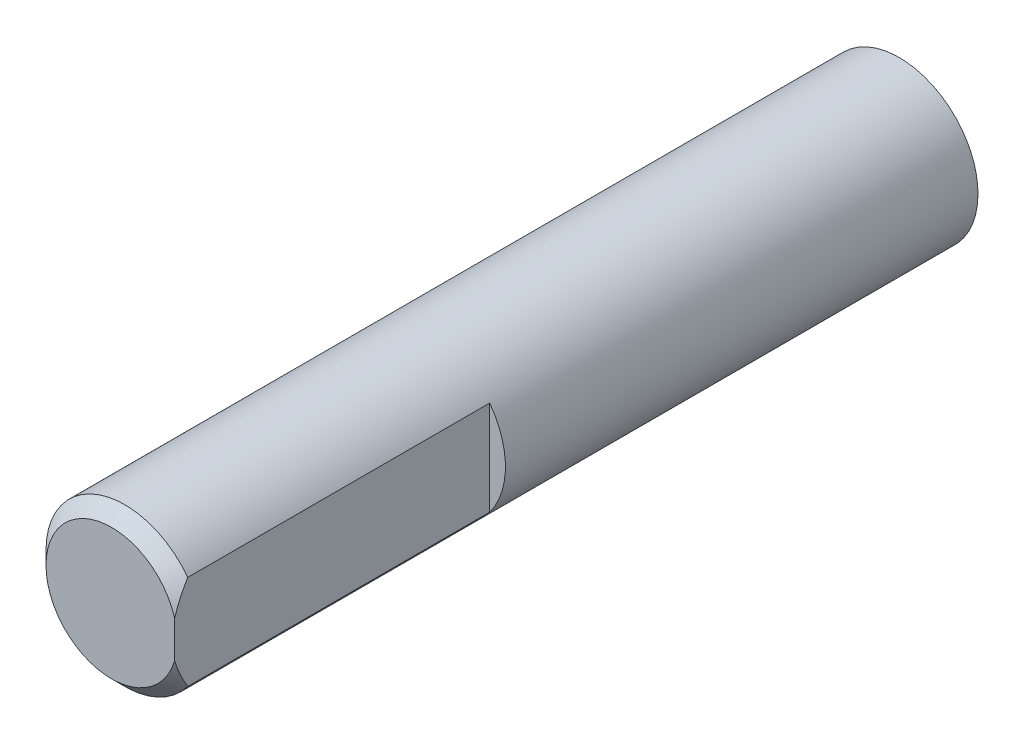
SolidWorks part; units mm, degrees
ref_plane "Plan de face" through (0, 0, 0) normal (0, 0, 1) x (1, 0, 0)
ref_plane "Plan de dessus" through (0, 0, 0) normal (0, 1, 0) x (1, 0, 0)
ref_plane "Plan de droite" through (0, 0, 0) normal (1, 0, 0) x (0, 0, -1)
sketch "Esquisse1" plane through (0, 0, 0) normal (0, 0, 1) x (1, 0, 0)
  circle A0 centre (0, 0) radius 3
  dimension "D1" = 6
extrude "Boss.-Extru.1" add sketch "Esquisse1" along normal blind 30
chamfer "Chanfrein1" distance 0.5 angle 45 1 edges at (3, 0, 30)
sketch "Esquisse3" plane through (0, 0, 30) normal (0, 0, 1) x (1, 0, 0)
  line L0 (0, 0) -> (3.4, 0) construction
  line L2 (2.4, 2.5) -> (4.4, 2.5)
  line L3 (2.4, 2.5) -> (2.4, -2.5)
  line L4 (2.4, -2.5) -> (4.4, -2.5)
  line L5 (4.4, 2.5) -> (4.4, -2.5)
  line L6 (2.4, 2.5) -> (4.4, -2.5) construction
  line L7 (2.4, -2.5) -> (4.4, 2.5) construction
  dimension "D1" = 2.4
  dimension "D2" = 5
  dimension "D3" = 2
extrude "Enlèv. mat.-Extru.1" cut sketch "Esquisse3" against normal blind 12
